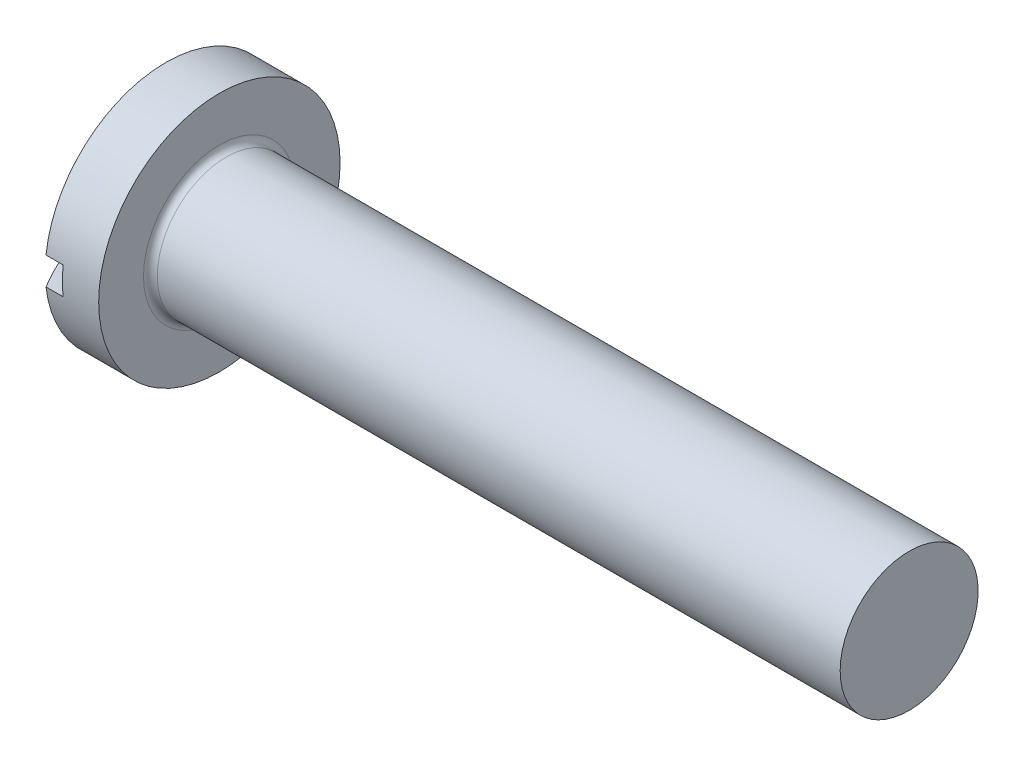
SolidWorks part; units mm, degrees
ref_plane "Front Plane" through (0, 0, 0) normal (0, 0, 1) x (1, 0, 0)
ref_plane "Top Plane" through (0, 0, 0) normal (0, 1, 0) x (1, 0, 0)
ref_plane "Right Plane" through (0, 0, 0) normal (1, 0, 0) x (0, 0, -1)
sketch "BodySke" plane through (0, 0, 0) normal (0, 0, 1) x (1, 0, 0)
  line L0 (0, 0) -> (120.5141, 0) construction
  line L1 (0, 0) -> (0, 50.5629) construction
  line L2 (5.1, 7) -> (5.1, 4)
  line L3 (5.1, 4) -> (45.1, 4)
  line L4 (45.1, 4) -> (45.1, 0)
  line L5 (0, 0) -> (45.1, 0)
  line L6 (5.1, 7) -> (2, 7)
  line L7 (6.35, 9.2217) -> (6.35, -4.3786) construction
  line L8 (15.1, 9.5609) -> (15.1, -6.7938) construction
  arc A0 (0, 0) -> (2, 7) centre (13.25, 0) cw
  point P14 (45.1, 3.3095)
  dimension "Diameter" = 8
  dimension "Head_height" = 3.1
  dimension "Length" = 40
  dimension "Head_dia" = 14
  dimension "Advance" = 1.25
  dimension "Thread_length" = 30
  dimension "Thread_minor" = 6.619
  dimension "Head_fillister" = 2
revolve "BaseBody" add sketch "BodySke" angle 360 about L0
fillet "Fillet1" radius 0.4 1 edges at (5.1, 0, 4)
sketch "SlotSke" plane through (0, 0, 0) normal (1, 0, 0) x (0, 0, -1)
  line L1 (7, 0.8) -> (-7, 0.8)
  line L2 (7, 0.8) -> (7, -0.8)
  line L3 (7, -0.8) -> (-7, -0.8)
  line L4 (-7, 0.8) -> (-7, -0.8)
  dimension "D1" = 14
  dimension "D2" = 7
  dimension "Slot_width" = 1.6
  dimension "D4" = 0.8
extrude "Slot" cut sketch "SlotSke" along normal blind 3
sketch "ThdSchSke" plane through (0, 0, 0) normal (0, 0, 1) x (1, 0, 0)
  line L0 (0, 0) -> (54.7976, 0) construction
  line L1 (44.7013, 4.7973) -> (44.7013, 4)
  line L2 (44.7013, 4.7973) -> (45.4987, 4.7973)
  line L3 (45.4987, 4.7973) -> (45.4987, 4)
  line L4 (45.4987, 4) -> (45.1, 3.3095)
  line L5 (45.1, 3.3095) -> (44.7013, 4)
  line L6 (5.1, 4) -> (45.1, 4) construction
revolve "ThreadSchematic" [suppressed] cut sketch "ThdSchSke" angle 360 about L0
pattern_linear "ThdSchPat" [suppressed] count 24 along (1, 0, 0)
equation "\"Thread_minor@ThreadCosmetic\" = \"Thread_minor@BodySke\""
equation "\"D1@SlotSke\" = \"Head_dia@BodySke\""
equation "\"D2@SlotSke\" = \"D1@SlotSke\" / 2"
equation "\"D4@SlotSke\" = \"Slot_width@SlotSke\" / 2"
equation "\"Advance@ThdSchPat\" = \"Advance@BodySke\""
equation "\"D1@ThdSchPat\" =  int( \"Thread_length@BodySke\" / \"Advance@BodySke\" ) "
